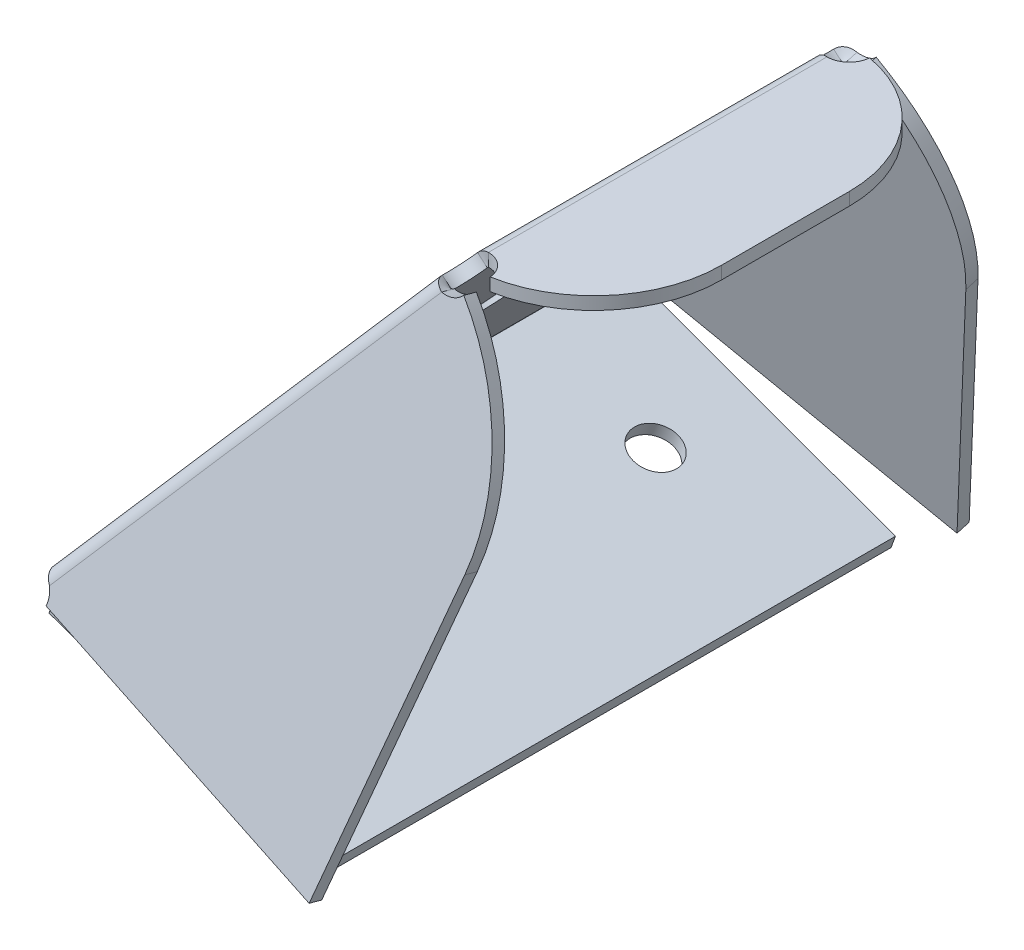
SolidWorks part; units mm, degrees
ref_plane "Front" through (0, 0, 0) normal (0, 0, 1) x (1, 0, 0)
ref_plane "Top" through (0, 0, 0) normal (0, 1, 0) x (1, 0, 0)
ref_plane "Right" through (0, 0, 0) normal (1, 0, 0) x (0, 0, -1)
sketch "Sketch1" plane through (0, 0, 0) normal (0, 1, 0) x (1, 0, 0)
  line L1 (0, -22.5) -> (0, 22.5)
  line L2 (24.8977, 24.0022) -> (37.3375, 44.8184)
  line L3 (37.3375, 44.8184) -> (57.3091, 31.1534)
  line L4 (74, -5) -> (74, 5)
  line L6 (0, 22.5) -> (22.25, 22.5)
  line L7 (0, -22.5) -> (22.25, -22.5)
  line L8 (37.3375, -44.8184) -> (57.3091, -31.1534)
  line L9 (24.8977, -24.0022) -> (37.3375, -44.8184)
  circle A0 centre (12, 15) radius 1.75
  arc A1 (22.25, 22.5) -> (24.8977, 24.0022) centre (24, 22.5) ccw
  arc A2 (64.2279, 16.7351) -> (65.7433, 14.8469) centre (64, 15) ccw
  arc A3 (74, 5) -> (65.7433, 14.8469) centre (64, 5) ccw
  arc A4 (64.2279, -16.7351) -> (57.3091, -31.1534) centre (48.274, -17.9486) cw
  arc A5 (64.2279, 16.7351) -> (57.3091, 31.1534) centre (48.274, 17.9486) ccw
  arc A6 (74, -5) -> (65.7433, -14.8469) centre (64, -5) cw
  arc A7 (64.2279, -16.7351) -> (65.7433, -14.8469) centre (64, -15) cw
  arc A8 (22.25, -22.5) -> (24.8977, -24.0022) centre (24, -22.5) cw
  circle A9 centre (12, -15) radius 1.75
  circle A10 centre (44, 0) radius 2.5
sheet metal parameters "Sheet-Metal1" thickness 1 parameters "D1"=0.01
base flange "Base-Flange1" sketch "Sketch1" thickness 1 reverse thickness direction yes parameters "D1"=0.01
sketch "Sketch3" plane through (0, 1, 0) normal (0, 1, 0) x (-1, 0, 0)
  line L0 (-24, -22.5) -> (-24, 22.7091)
sketched bend "Sketched Bend1" parameters "D1"=0.01
bend "SketchBend1" bend radius 0.01 bend angle 110 parameters "D5"=1
sketch "Sketch4" plane through (0, 1, 0) normal (0, 1, 0) x (-1, 0, 0)
  line L0 (-24, -22.5) -> (-64, -15)
  line L1 (-64, 15) -> (-24, 22.5)
sketched bend "Sketched Bend2" parameters "D1"=0
bend "SketchBend2" bend radius 0.01 bend angle 80 parameters "D5"=2
bend "SketchBend3" bend radius 0 bend angle 80 parameters "D5"=3
sketch "Sketch6" plane through (0, 1, 0) normal (0, 1, 0) x (-1, 0, 0)
  line L0 (-64, 15) -> (-64, -15)
sketched bend "Sketched Bend3" parameters "D1"=0.01
bend "SketchBend4" bend radius 0.01 bend angle 50 parameters "D5"=4
flat pattern "Flat-Pattern1"
sketch "Bend-Lines1" plane through (0, 1, 0) normal (0, 1, 0) x (-1, 0, 0)
  line L0 (-25.7476, 22.5921) -> (-62.4045, 15.7189) construction
  line L1 (-62.4045, -15.7189) -> (-25.7476, -22.5921) construction
  line L2 (-23.4354, 20.8436) -> (-23.4354, -20.8436) construction
bend of the flat pattern "Flatten-<SketchBend1>1"
bend of the flat pattern "Flatten-<SketchBend2>1"
bend of the flat pattern "Flatten-<SketchBend3>1"
bend of the flat pattern "Flatten-<SketchBend4>1"
